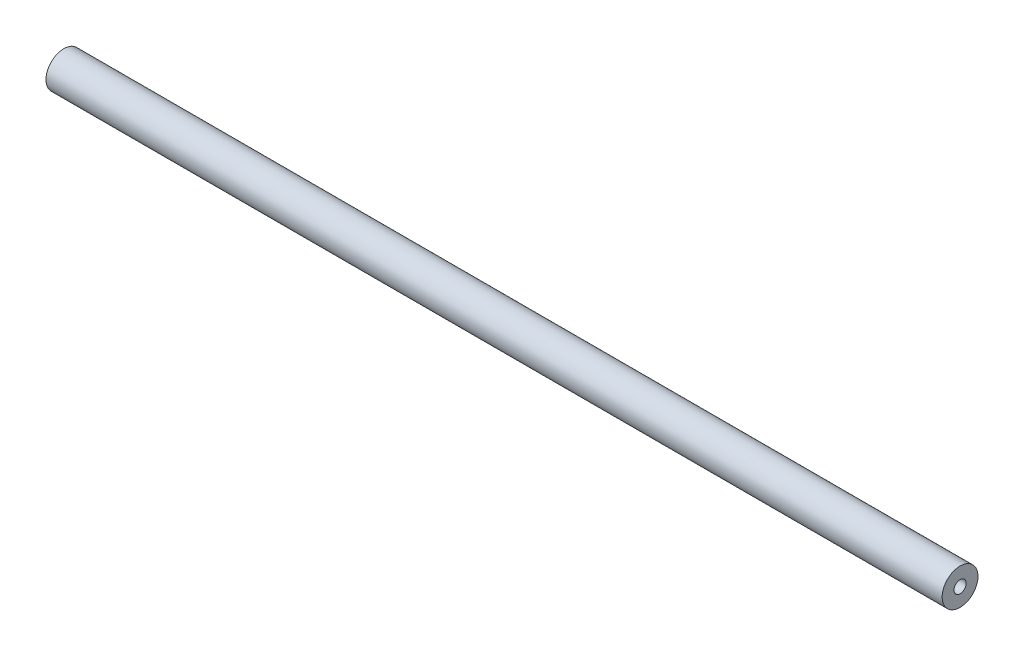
SolidWorks part; units mm, degrees
ref_plane "Plan de face" through (0, 0, 0) normal (0, 0, 1) x (1, 0, 0)
ref_plane "Plan de dessus" through (0, 0, 0) normal (0, 1, 0) x (1, 0, 0)
ref_plane "Plan de droite" through (0, 0, 0) normal (1, 0, 0) x (0, 0, -1)
sketch "Esquisse1" plane through (0, 0, 0) normal (1, 0, 0) x (0, 0, -1)
  circle A0 centre (0, 0) radius 10
  dimension "D1" = 20
extrude "Extrusion1" add sketch "Esquisse1" along normal mid plane 500
hole_wizard "Trou taraudé M8x1.251" positions "Esquisse3" profile "Esquisse2" tap size "M8x1.25" standard "ISO"
sketch "Esquisse3" plane through (250, 0, 0) normal (1, 0, 0) x (0, 0, -1)
  circle A0 centre (0, 0) radius 10 construction
  point P0 (0, 0)
sketch "Esquisse2" plane through (250, 0, 0) normal (0, 1, 0) x (0, 0, -1)
  line L0 (0, 0) -> (0, 22.0429)
  line L1 (0, 22.0429) -> (3.4, 20)
  line L2 (3.4, 20) -> (3.4, 0)
  line L5 (3.4, 0) -> (0, 0)
  line L10 (0, 22.0429) -> (-3.4, 20) construction
  line L11 (0, -6.35) -> (0, 107.95) construction
  dimension "Diamètre du trou pour taraudage" = 6.8
  dimension "Profondeur du trou pour taraudage" = 20
  dimension "Angle de pointe" = 118
hole_wizard "Trou taraudé M8x1.252" positions "Esquisse5" profile "Esquisse4" tap size "M8x1.25" standard "ISO"
sketch "Esquisse5" plane through (-250, 0, 0) normal (-1, 0, 0) x (0, 0, 1)
  circle A0 centre (0, 0) radius 10 construction
  point P0 (0, 0)
sketch "Esquisse4" plane through (-250, 0, 0) normal (0, 1, 0) x (0, 0, 1)
  line L0 (0, 0) -> (0, 22.0429)
  line L1 (0, 22.0429) -> (3.4, 20)
  line L2 (3.4, 20) -> (3.4, 0)
  line L5 (3.4, 0) -> (0, 0)
  line L10 (0, 22.0429) -> (-3.4, 20) construction
  line L11 (0, -6.35) -> (0, 107.95) construction
  dimension "Diamètre du trou pour taraudage" = 6.8
  dimension "Profondeur du trou pour taraudage" = 20
  dimension "Angle de pointe" = 118
